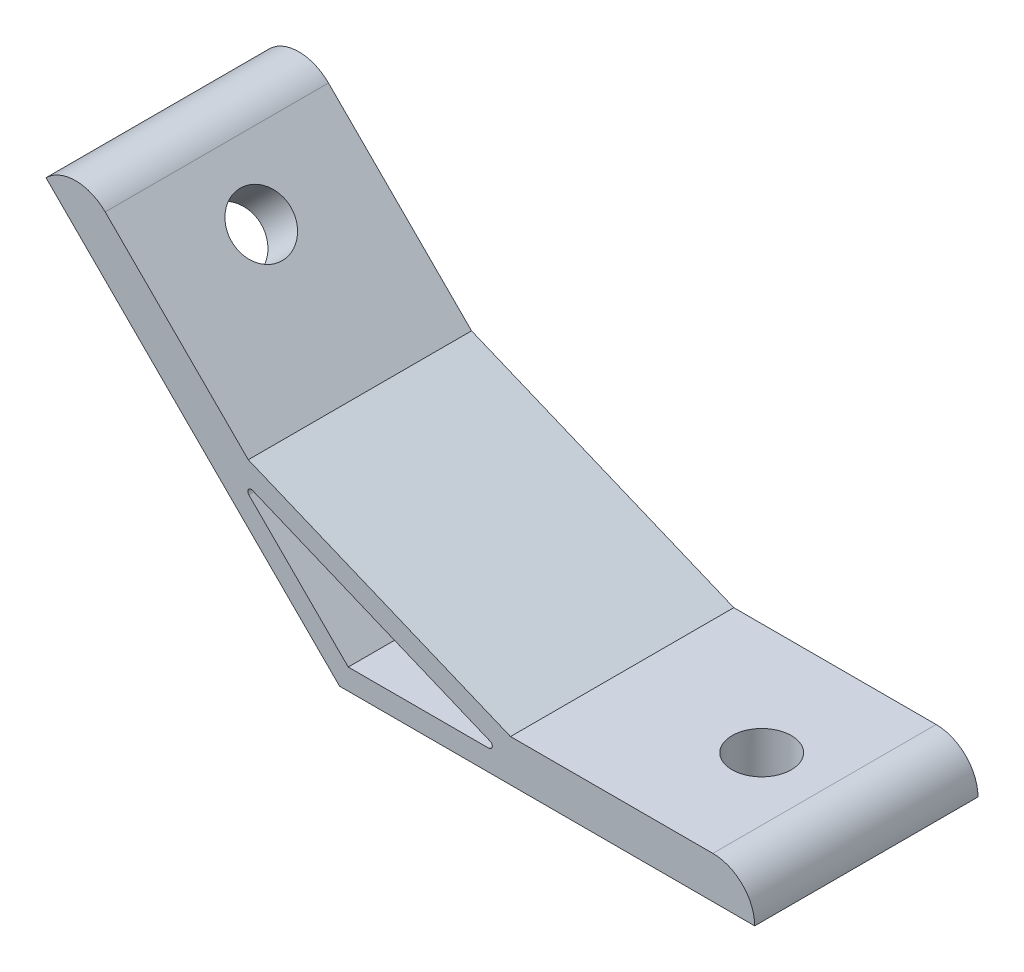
SolidWorks part; units mm, degrees
ref_plane "前视基准面" through (0, 0, 0) normal (0, 0, 1) x (1, 0, 0)
ref_plane "上视基准面" through (0, 0, 0) normal (0, 1, 0) x (1, 0, 0)
ref_plane "右视基准面" through (0, 0, 0) normal (1, 0, 0) x (0, 0, -1)
sketch "草图1" plane through (0, 0, 0) normal (0, 0, 1) x (1, 0, 0)
  line L0 (0, 0) -> (59.5, 0)
  line L1 (59.5, 0) -> (59.5, 6)
  line L2 (59.5, 6) -> (24.5, 6)
  line L3 (-42.0729, 42.0729) -> (-37.8302, 46.3155)
  line L4 (0, 0) -> (-42.0729, 42.0729)
  line L5 (-37.8302, 46.3155) -> (-13.0815, 21.5668)
  line L6 (-13.0815, 21.5668) -> (24.5, 6)
  dimension "D1" = 6
  dimension "D2" = 6
  dimension "D3" = 59.5
  dimension "D4" = 59.5
  dimension "D6" = 35
  dimension "D7" = 135
  dimension "D9" = 35
extrude "凸台-拉伸1" add sketch "草图1" along normal mid plane 32
sketch "草图2" plane through (0, 0, 16) normal (0, 0, 1) x (1, 0, 0)
  line L0 (-14.7808, 19.0235) -> (23.9033, 3)
  line L1 (-14.7808, 19.0235) -> (1.2426, 3)
  line L2 (1.2426, 3) -> (23.9033, 3)
  line L3 (0, 0) -> (59.5, 0) construction
  line L4 (-42.0729, 42.0729) -> (0, 0) construction
  line L6 (24.5, 6) -> (-13.0815, 21.5668) construction
  dimension "D1" = 3
  dimension "D2" = 3
  dimension "D3" = 22.5
  dimension "D4" = 22.5
  dimension "D5" = 3
extrude "切除-拉伸1" cut sketch "草图2" against normal through all
fillet "圆角1" radius 0.5 1 edges at (-14.7808, 19.0235, 0)
sketch "草图4" plane through (0, 0, 0) normal (-0.7071, -0.7071, 0) x (0.7071, -0.7071, 0)
  line L0 (-59.5, 16) -> (-59.5, -16) construction
  line L1 (-59.5, 16) -> (0, 16) construction
  circle A0 centre (-44.5, 0) radius 4.25
  dimension "D2" = 8.5
  dimension "D1" = 15
  dimension "D3" = 16
extrude "切除-拉伸2" cut sketch "草图4" against normal blind 32
fillet "圆角2" radius 6 1 edges at (-37.8302, 46.3155, 0)
ref_plane "基准面1" through (0, 0, 0) normal (-0.9239, 0.3827, 0) x (0, 0, 1)
mirror "镜向4" about plane through (0, 0, 0) normal (-0.9239, 0.3827, 0) of "切除-拉伸2"
fillet "圆角3" radius 6 1 edges at (59.5, 6, 0)
fillet "圆角4" radius 0.5 1 edges at (23.9033, 3, 0)
